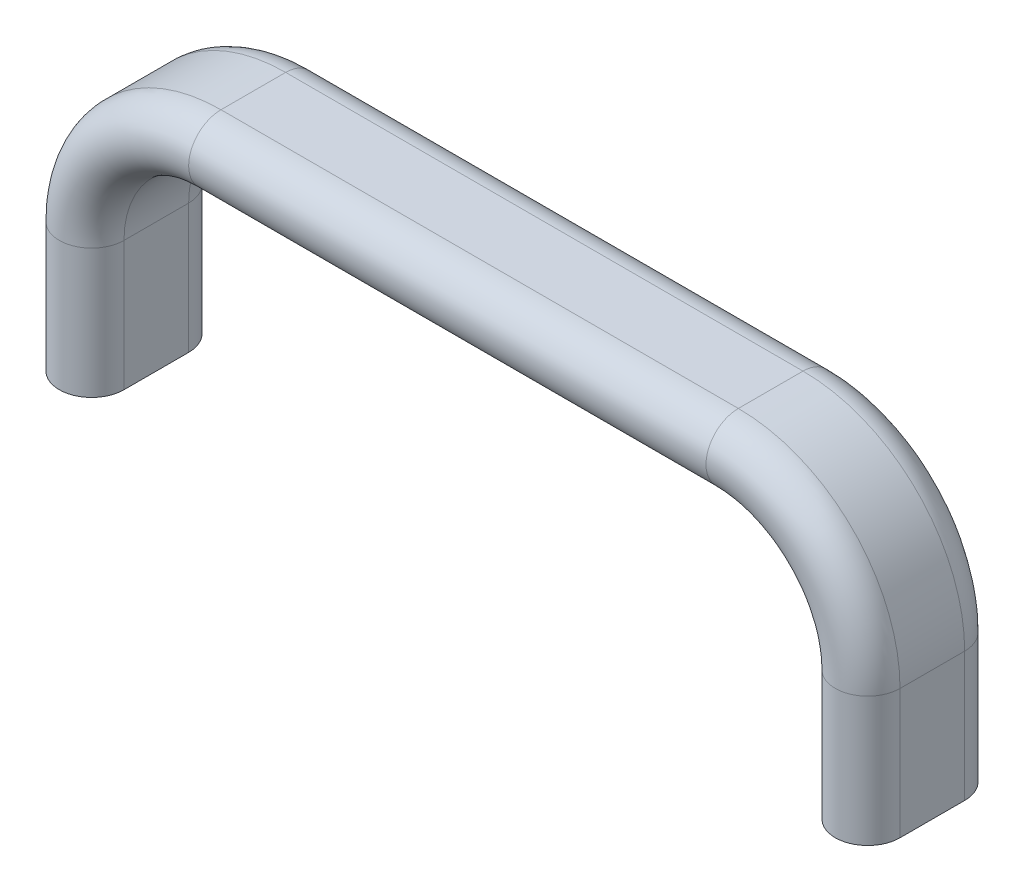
SolidWorks part; units mm, degrees
ref_plane "Front Plane" through (0, 0, 0) normal (0, 0, 1) x (1, 0, 0)
ref_plane "Top Plane" through (0, 0, 0) normal (0, 1, 0) x (1, 0, 0)
ref_plane "Right Plane" through (0, 0, 0) normal (1, 0, 0) x (0, 0, -1)
sketch "Sketch1" plane through (0, 0, 0) normal (0, 0, 1) x (1, 0, 0)
  line L0 (-60, 0) -> (-60, 20)
  line L1 (-40, 40) -> (40, 40)
  line L2 (0, 0) -> (0, 50000) construction
  line L3 (60, 0) -> (60, 20)
  arc A0 (-60, 20) -> (-40, 40) centre (-40, 20) cw
  arc A1 (60, 20) -> (40, 40) centre (40, 20) ccw
  point P9 (0, 40)
  dimension "D3" = 20
  dimension "D1" = 120
  dimension "D2" = 40
sketch "Sketch2" plane through (0, 0, 0) normal (0, 1, 0) x (1, 0, 0)
  line L0 (-65, -5) -> (-65, 5)
  line L1 (-55, 5) -> (-55, -5)
  line L2 (0, 0) -> (-50000, 0) construction
  line L3 (-60, -10) -> (-60, 10) construction
  arc A0 (-65, 5) -> (-55, 5) centre (-60, 5) cw
  arc A1 (-65, -5) -> (-55, -5) centre (-60, -5) ccw
  point P0 (-60, 10)
  point P6 (-65, 0)
  point P10 (-55, 0)
  point P11 (-60, -10)
  point P15 (-60, 0)
  dimension "D1" = 10
  dimension "D2" = 20
sweep "Sweep1" add profiles "Sketch2" path "Sketch1"
sketch "Sketch3" plane through (0, 0, 0) normal (0, -1, 0) x (1, 0, 0)
  circle A0 centre (-60, 0) radius 2.1
  dimension "D1" = 4.2
  dimension "D2" = 60
extrude "Extrude1" cut sketch "Sketch3" against normal blind 12.5
sketch "Sketch4" plane through (0, 0, 0) normal (0, -1, 0) x (1, 0, 0)
  circle A0 centre (-60, 0) radius 2.5
  dimension "D1" = 5
extrude "Extrude2" cut sketch "Sketch4" against normal blind 10
sketch "Sketch5" plane through (0, 0, 0) normal (0, 0, 1) x (1, 0, 0)
  line L0 (-60, 12.5) -> (-62.1, 12.5)
  line L1 (-62.1, 12.5) -> (-60, 13.7124)
  line L2 (-60, 13.7124) -> (-60, 12.5)
  dimension "D1" = 30
  dimension "D2" = 2.1
  dimension "D3" = 12.5
  dimension "D4" = 60
revolve "Cut-Revolve1" cut sketch "Sketch5" angle 360 about L2
mirror "Mirror1" about plane through (0, 0, 0) normal (1, 0, 0) of "Cut-Revolve1", "Extrude2", "Extrude1"
equation "\"D2@Sketch3\" = \"D1@Sketch1\"/2"
equation "\"D2@Sketch5\" = \"D1@Sketch3\"/2"
equation "\"D3@Sketch5\" = \"D1@Extrude1\""
equation "\"D4@Sketch5\" = \"D1@Sketch1\"/2"
